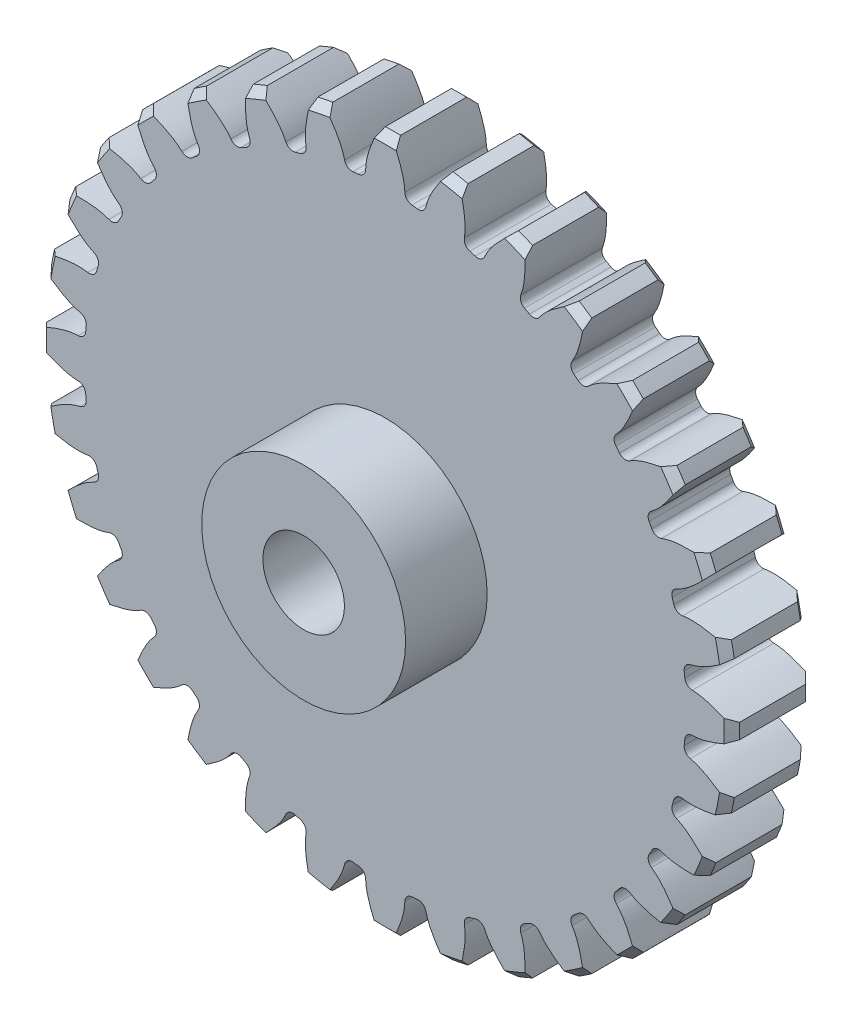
SolidWorks part; units mm, degrees
ref_plane "Plan1" through (0, 0, 0) normal (0, 0, 1) x (1, 0, 0)
ref_plane "Plan2" through (0, 0, 0) normal (0, 1, 0) x (1, 0, 0)
ref_plane "Plan3" through (0, 0, 0) normal (1, 0, 0) x (0, 0, -1)
sketch "Dent" plane through (0, 0, 0) normal (0, 0, 1) x (1, 0, 0)
  line L1 (-0.1859, 6.5063) -> (0, 5.9955)
  line L3 (0, 8.5) -> (0, -8.5) construction
  line L4 (0, 0) -> (0.1859, 8.498) construction
  line L5 (0.3927, 7.9904) -> (-0.3927, 7.9904) construction
  line L6 (0.4809, 7.5021) -> (-0.4809, 7.5021) construction
  line L7 (-0.25, 0) -> (0.25, 0) construction
  line L9 (0.1859, 6.5063) -> (0, 5.9955)
  line L11 (0, 0) -> (0.3927, 7.9904) construction
  line L12 (0, 0) -> (0.4809, 7.5021) construction
  circle A0 centre (0, 0) radius 8 construction
  circle A1 centre (0, 0) radius 8.5 construction
  arc A2 (0.1859, 8.498) -> (-0.1859, 8.498) centre (0, 0) ccw
  circle A3 centre (0, 0) radius 7.5175 construction
  point P2 (-0.3927, 7.9904)
  point P3 (-0.4809, 7.5021)
  point P19 (0.3927, 7.9904)
  point P20 (0.4809, 7.5021)
sketch "Esquisse2" plane through (0, 0, 0) normal (0, 0, 1) x (1, 0, 0)
  circle A0 centre (0, 0) radius 7.375
extrude "Base-Extrusion" add sketch "Esquisse2" against normal blind 2
extrude "Boss.-Extru.1" add sketch "Dent" against normal blind 2
fillet "Congé1" radius 0.19 4 edges at (0.4704, 7.36, -1) (-0.4707, 7.36, -1)
chamfer "Chanfrein1" distance 0.19 angle 45 4 edges at (0, 8.5, -2) (0, 8.5, 0)
pattern_circular "Répétition circulaire1" count 32 over 360 of "Congé1", "Boss.-Extru.1", "Chanfrein1"
sketch "Esquisse3" plane through (0, 0, 0) normal (0, 0, 1) x (1, 0, 0)
  circle A0 centre (0, 0) radius 2.5
  dimension "D1" = 5
extrude "Extrusion1" add sketch "Esquisse3" along normal blind 2
sketch "Esquisse4" plane through (0, 0, 2) normal (0, 0, 1) x (1, 0, 0)
  circle A0 centre (0, 0) radius 1
  dimension "D1" = 2
extrude "Enlèv. mat.-Extru.1" cut sketch "Esquisse4" against normal through all
equation "\"Dp@Dent\" = \"Module@Dent\"*\"Nbr de dents@Répétition circulaire1\" "
equation "\"Dt@Dent\" = \"Module@Dent\"*(\"Nbr de dents@Répétition circulaire1\"+2)"
equation "\"Dpied@Esquisse2\" = \"Dp@Dent\"-(2.5*\"Module@Dent\")"
equation "\"Db@Dent\" = \"Dp@Dent\"*cos(\"Angle de pression@Dent\"*pi/180)"
equation "\"Ep au primitif@Dent\" =  (pi*\"Dp@Dent\"/2)/\"Nbr de dents@Répétition circulaire1\""
equation "\"D3@Dent\"=atn((Sin((sqr(((\"Dt@Dent\"/\"Db@Dent\")^2)-1))) -((sqr(((\"Dt@Dent\"/\"Db@Dent\")^2)-1)) * Cos((sqr(((\"Dt@Dent\"/\"Db@Dent\")^2)-1)))))/(Cos((sqr(((\"Dt@Dent\"/\"Db@Dent\")^2)-1))) +((sqr(((\"Dt@Dent\"/\"Db@"
equation "\"D4@Dent\"=atn((Sin((sqr(((\"Dp@Dent\"/\"Db@Dent\")^2)-1))) -((sqr(((\"Dp@Dent\"/\"Db@Dent\")^2)-1)) * Cos((sqr(((\"Dp@Dent\"/\"Db@Dent\")^2)-1)))))/(Cos((sqr(((\"Dp@Dent\"/\"Db@Dent\")^2)-1))) +((sqr(((\"Dp@Dent\"/\"Db@"
equation "\"D1@Congé1\" = \"Module@Dent\"*0.38"
equation "\"D1@Chanfrein1\" = \"Module@Dent\"*0.38"
equation "\"D1@Base-Extrusion\" = \"Epaisseur@Boss.-Extru.1\""
